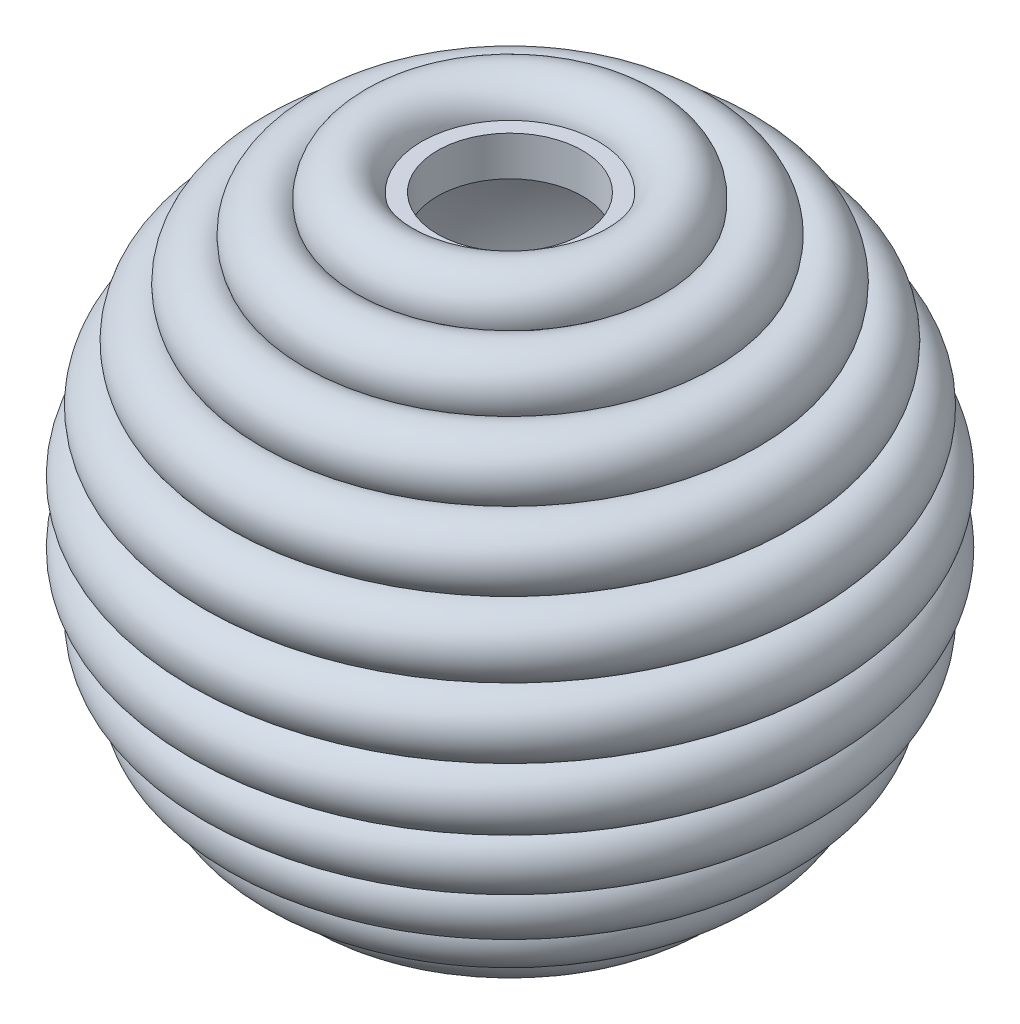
SolidWorks part; units mm, degrees
ref_plane "Alzado" through (0, 0, 0) normal (0, 0, 1) x (1, 0, 0)
ref_plane "Planta" through (0, 0, 0) normal (0, 1, 0) x (1, 0, 0)
ref_plane "Vista lateral" through (0, 0, 0) normal (1, 0, 0) x (0, 0, -1)
sketch "Croquis1" plane through (0, 0, 0) normal (0, 0, 1) x (1, 0, 0)
  line L0 (0, 43.8694) -> (0, -50) construction
  line L4 (0, -44) -> (0, -50)
  line L6 (-15.6846, 41.1095) -> (-13.3031, 41.1095)
  arc A2 (-4.8552, -46.1945) -> (0, -50) centre (0, -45) ccw
  arc A3 (-14.3535, -44.1755) -> (-4.8552, -46.1945) centre (-9.356, -44.0166) ccw
  arc A4 (-23.2245, -40.2259) -> (-14.3535, -44.1755) centre (-18.3031, -41.1095) ccw
  arc A5 (-31.0804, -34.5183) -> (-23.2245, -40.2259) centre (-26.4503, -36.4058) ccw
  arc A6 (-37.578, -27.302) -> (-31.0804, -34.5183) centre (-33.4415, -30.1109) ccw
  arc A7 (-42.4332, -18.8925) -> (-37.578, -27.302) centre (-38.9711, -22.5) ccw
  arc A8 (-45.4339, -9.6573) -> (-42.4332, -18.8925) centre (-42.7975, -13.9058) ccw
  arc A11 (-42.4332, 18.8925) -> (-45.4339, 9.6573) centre (-42.7975, 13.9058) ccw
  arc A13 (-31.0804, 34.5183) -> (-37.578, 27.302) centre (-33.4415, 30.1109) ccw
  arc A14 (-23.2245, 40.2259) -> (-31.0804, 34.5183) centre (-26.4503, 36.4058) ccw
  arc A18 (-37.578, 27.302) -> (-42.4332, 18.8925) centre (-38.9711, 22.5) ccw
  arc A19 (-4.5008, 42.8222) -> (-4.8552, 46.1945) centre (-9.356, 44.0166) ccw
  arc A20 (-4.5008, 42.8222) -> (0, 40) centre (0, 45) ccw
  arc A21 (-45.4339, 9.6573) -> (-46.4489, 0) centre (-44.7535, 4.7038) ccw
  arc A22 (-34.8347, 25.3089) -> (-36.2344, 26.6846) centre (-38.9711, 22.5) ccw
  arc A23 (-46.4489, 0) -> (-45.4339, -9.6573) centre (-44.7535, -4.7038) ccw
  arc A24 (-42.1171, 8.9523) -> (-43.9554, 9.6397) centre (-44.7535, 4.7038) ccw
  arc A25 (-15.6846, 41.1095) -> (0, -44) centre (0, 0) ccw
  arc A26 (-43.0581, 0) -> (-44.9991, 0.2902) centre (-44.7535, -4.7038) ccw
  arc A28 (-13.3031, 41.1095) -> (-23.2245, 40.2259) centre (-18.3031, 41.1095) ccw
  arc A29 (-16.875, 45.9012) -> (-23.2245, 40.2259) centre (-18.3031, 41.1095) ccw
  point P41 (0, 0)
  dimension "D2" = 16
revolve "Revolución1" add sketch "Croquis1" angle 360 about L0
ref_plane "Plano1" through (0, 41, 0) normal (0, 1, 0) x (1, 0, 0)
sketch "Croquis2" plane through (0, 41, 0) normal (0, 1, 0) x (1, 0, 0)
  circle A1 centre (0, 0) radius 14.3535 construction
  circle A2 centre (0, 0) radius 15
  point P1 (0, 0)
  dimension "D1" = 30
extrude "Saliente-Extruir1" add sketch "Croquis2" along normal blind 1 and the other way blind 5
sketch "Croquis3" plane through (0, 42, 0) normal (0, 1, 0) x (1, 0, 0)
  circle A0 centre (0, 0) radius 11
  dimension "D1" = 22
extrude "Cortar-Extruir1" cut sketch "Croquis3" against normal blind 10
